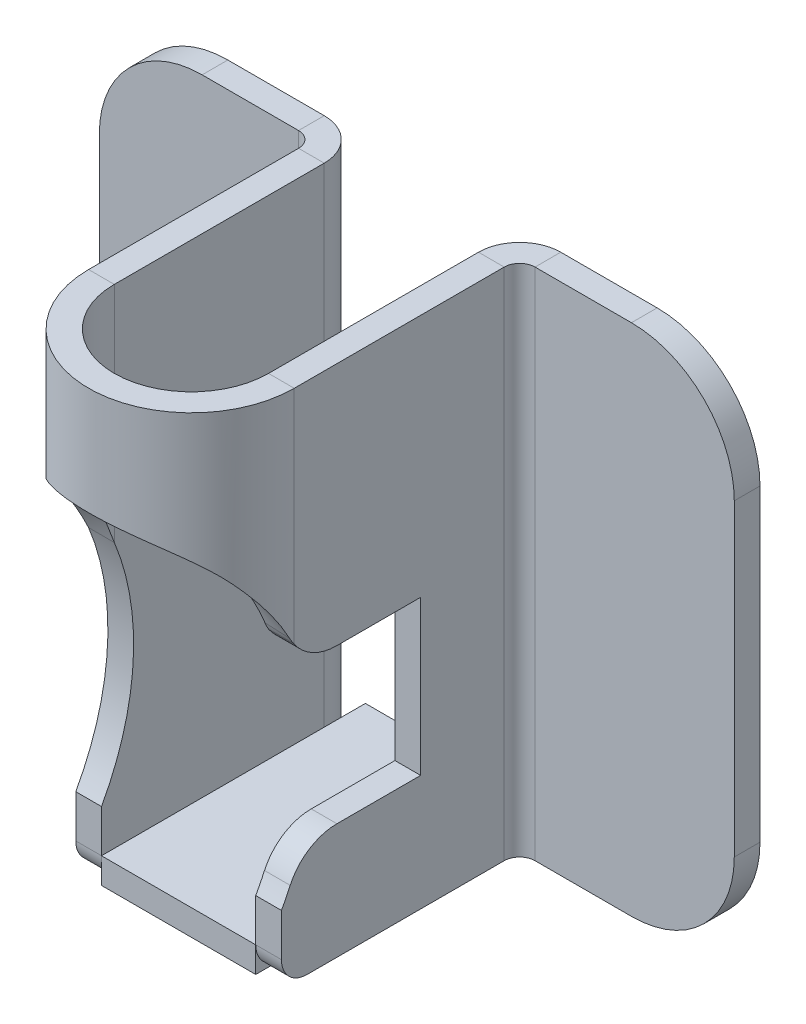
SolidWorks part; units mm, degrees
extrude "Base-Extrusion" add sketch "Esquisse1" along normal blind 2
sketch "Esquisse1" plane through (0, 0, 0) normal (0, 0, 1) x (1, 0, 0)
  line L0 (43.83, 0) -> (43.83, 15) construction
  line L1 (8, 0) -> (31.83, 0)
  line L2 (36.33, 15) -> (51.33, 15) construction
  line L3 (8, 40) -> (79.66, 40)
  line L4 (55.83, 0) -> (79.66, 0)
  line L5 (87.66, 32) -> (87.66, 8)
  line L6 (0, 32) -> (0, 8)
  line L7 (53.83, 5.3175) -> (53.83, 2)
  line L8 (33.83, 5.3175) -> (33.83, 2)
  line L9 (71.66, 40) -> (71.66, 0) construction
  line L10 (16, 40) -> (16, 0) construction
  line L16 (58.1474, 21) -> (64.66, 21)
  line L17 (64.66, 21) -> (64.66, 9)
  line L18 (64.66, 9) -> (58.1474, 9)
  arc A0 (87.66, 32) -> (79.66, 40) centre (79.66, 32) ccw
  arc A1 (79.66, 0) -> (87.66, 8) centre (79.66, 8) ccw
  arc A2 (51.33, 28.2288) -> (36.33, 28.2288) centre (43.83, 21.6144) ccw
  arc A3 (36.33, 28.2288) -> (33.83, 5.3175) centre (51.33, 15) ccw
  arc A4 (53.83, 5.3175) -> (54.5112, 6.6667) centre (36.33, 15) ccw
  arc A5 (0, 8) -> (8, 0) centre (8, 8) ccw
  arc A6 (8, 40) -> (0, 32) centre (8, 32) ccw
  arc A7 (54.5112, 23.3333) -> (51.33, 28.2288) centre (36.33, 15) ccw
  arc A8 (55.83, 0) -> (53.83, 2) centre (55.83, 2) cw
  arc A9 (33.83, 2) -> (31.83, 0) centre (31.83, 2) cw
  arc A10 (58.1474, 9) -> (54.5112, 6.6667) centre (58.1474, 5) ccw
  arc A11 (54.5112, 23.3333) -> (58.1474, 21) centre (58.1474, 25) ccw
  point P20 (0, 0)
  point P41 (55.4088, 21)
  dimension "D1" = 40
  dimension "D5" = 15
  dimension "D6" = 10
  dimension "D4" = 8
  dimension "D9" = 2
  dimension "D12" = 2
  dimension "D13" = 4
  dimension "D2" = 15
  dimension "D3" = 40
  dimension "D7" = 87.66
  dimension "D8" = 20
  dimension "D10" = 16
  dimension "D11" = 16
  dimension "D17" = 7
  dimension "D18" = 12
bend "Pli défini à plat2" bend angle 90 parameters "D1"=0, "D5"=2
bend "Pli défini à plat1" bend angle 90 parameters "D1"=0, "D5"=1, "RD3"=38.03, "RD5"=16.7043, "RD8"=9.7
ref_plane "Plan1" through (0, 0, 0) normal (0, 0, 1) x (1, 0, 0)
ref_plane "Plan2" through (0, 0, 0) normal (0, 1, 0) x (1, 0, 0)
ref_plane "Plan3" through (0, 0, 0) normal (1, 0, 0) x (0, 0, -1)
sheet metal parameters "Tôlerie 1" parameters "D1"=6, "Epaisseur"=2
flatten bends "Dépliage 1" parameters "D1"=0
sketch "Esquisse-Angle1" plane through (0, 0, 2) normal (0, 0, 1) x (1, 0, 0)
process bends "Pliage 1" parameters "D1"=1.2
sketch "Esquisse-Plate1" plane through (0, 0, 2) normal (0, 0, 1) x (1, 0, 0)
  line L0 (43.83, 0) -> (43.83, 15) construction
  line L1 (71.66, 0) -> (71.66, 40) construction
  line L2 (16, 40) -> (16, 0) construction
  line L3 (71.66, 0) -> (71.66, 40)
  line L4 (16, 40) -> (16, 0)
  line L5 (43.83, -15) -> (43.83, 47)
  point P4 (79.66, 20)
bend "Pli défini à plat3" bend radius 6 bend angle 180 parameters "D5"=3
sketch "Esquisse2" plane through (0, 0, 0) normal (0, 0, -1) x (-1, 0, 0)
  line L0 (-68.96, 0) -> (-68.96, 40) construction
  line L1 (-56.96, 0) -> (-56.96, 40) construction
  line L2 (-68.96, 0) -> (-68.96, 2)
  line L3 (-56.96, 0) -> (-56.96, 2)
  line L4 (-72.16, 0) -> (-79.66, 0) construction
  line L5 (-56.96, 0) -> (-68.96, 0)
  line L6 (-68.96, 2) -> (-56.96, 2)
  dimension "D1" = 2
extrude "Boss.-Extru.1" add sketch "Esquisse2" along normal up to surface (20.53 mm away)
